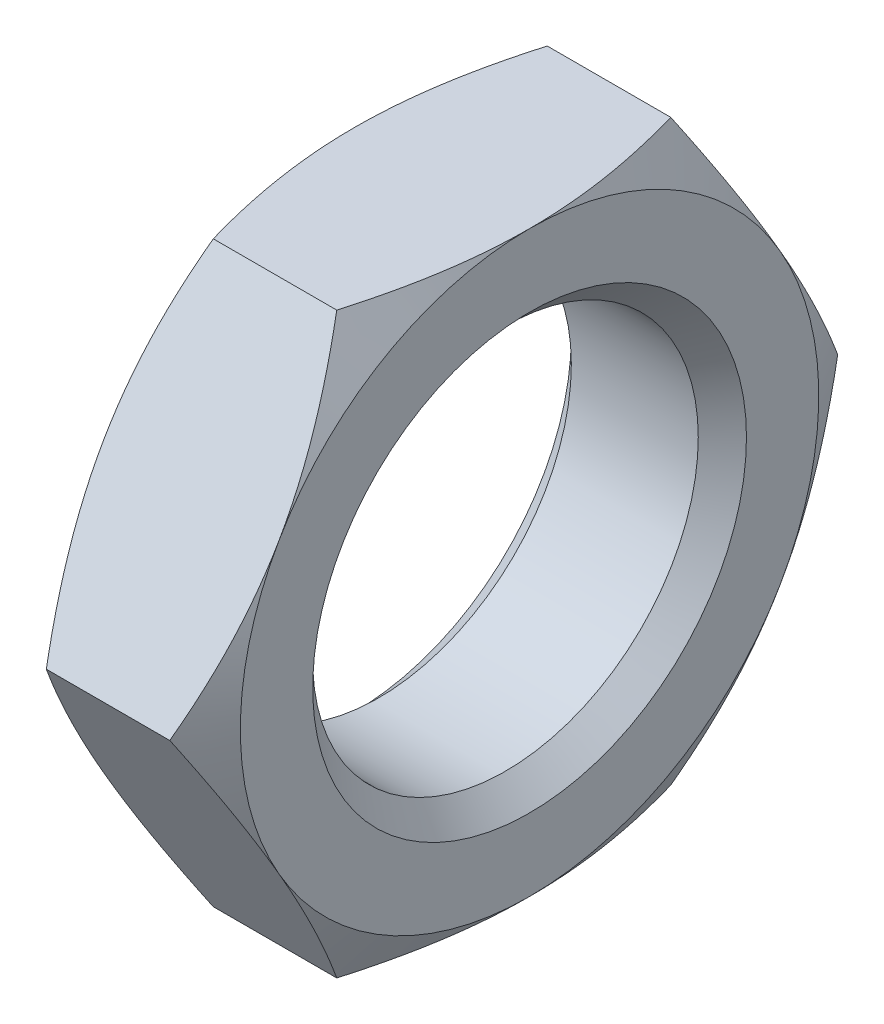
SolidWorks part; units mm, degrees
ref_plane "Front Plane" through (0, 0, 0) normal (0, 0, 1) x (1, 0, 0)
ref_plane "Top Plane" through (0, 0, 0) normal (0, 1, 0) x (1, 0, 0)
ref_plane "Right Plane" through (0, 0, 0) normal (1, 0, 0) x (0, 0, -1)
sketch "Sketch1" plane through (0, 0, 0) normal (1, 0, 0) x (0, 0, -1)
  line L1 (10.3923, 18) -> (-10.3923, 18)
  line L2 (-10.3923, 18) -> (-20.7846, 0)
  line L3 (-20.7846, 0) -> (-10.3923, -18)
  line L4 (-10.3923, -18) -> (10.3923, -18)
  line L5 (10.3923, -18) -> (20.7846, 0)
  line L6 (20.7846, 0) -> (10.3923, 18)
  circle A0 centre (0, 0) radius 18 construction
  circle A1 centre (0, 0) radius 12
extrude "Extrude1" add sketch "Sketch1" along normal blind 10.9
sketch "Sketch2" plane through (0, 0, 0) normal (0, 0, 1) x (1, 0, 0)
  line L0 (10.9, 18) -> (10.9, 72)
  line L1 (10.9, 72) -> (0, 72)
  line L2 (0, 72) -> (0, 18)
  line L3 (0, 18) -> (5.45, 27.4397)
  line L4 (5.45, 27.4397) -> (10.9, 18)
revolve "Cut-Revolve1" cut sketch "Sketch2" angle 360 about axis through (10.9, 0, 0) along (-1, 0, 0)
chamfer "Chamfer1" distance 1.5 angle 45 2 edges at (0, 0, -12) (10.9, 0, -12)
equation "\"D2@Sketch2\"=\"D1@Sketch1\"*2"
